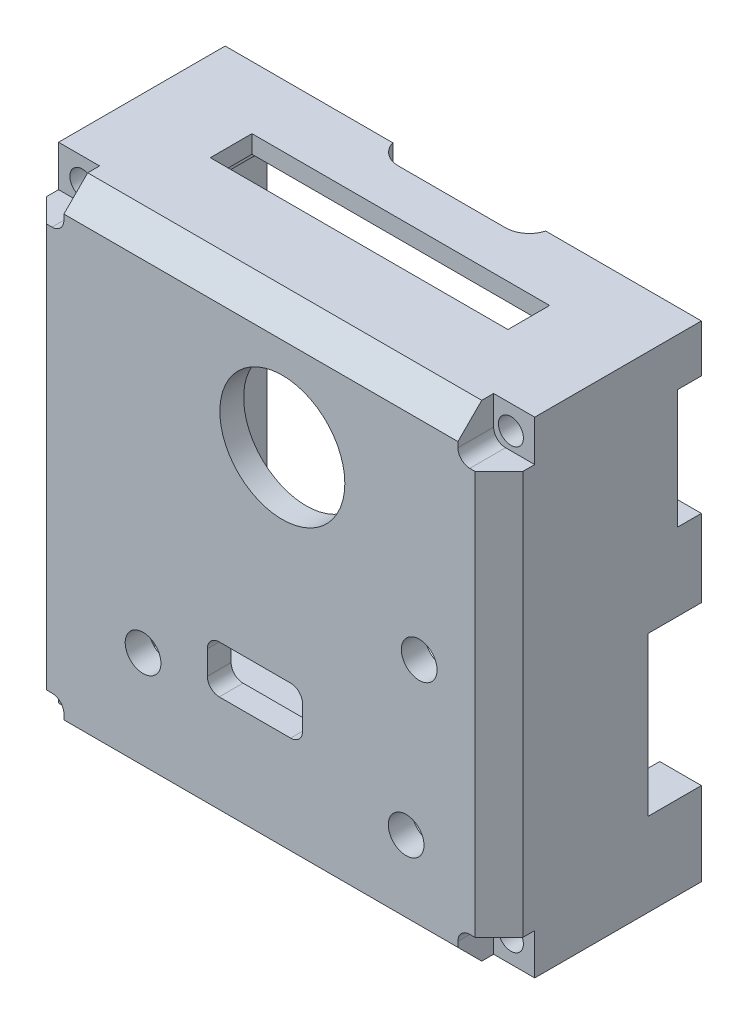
SolidWorks part; units mm, degrees
ref_plane "Alzado" through (0, 0, 0) normal (0, 0, 1) x (1, 0, 0)
ref_plane "Planta" through (0, 0, 0) normal (0, 1, 0) x (1, 0, 0)
ref_plane "Vista lateral" through (0, 0, 0) normal (1, 0, 0) x (0, 0, -1)
sketch "Sketch1" plane through (0, 0, 0) normal (0, 0, 1) x (1, 0, 0)
  line L6 (-20, 20.4) -> (20, 20.4)
  line L11 (-20, 20.4) -> (-20, -20.4)
  line L12 (-20, -20.4) -> (20, -20.4)
  line L18 (20, 20.4) -> (20, -20.4)
  line L19 (-20, 20.4) -> (20, -20.4) construction
  line L20 (-20, -20.4) -> (20, 20.4) construction
  point P0 (0, 0)
extrude "Boss-Extrude1" add sketch "Sketch1" along normal blind 17
sketch "Sketch2" plane through (0, 0, 0) normal (0, 0, -1) x (-1, 0, 0)
  line L1 (-16.5, -16.8) -> (16.5, -16.8)
  line L2 (-16.5, -16.8) -> (-16.5, 16.8)
  line L3 (-16.5, 16.8) -> (16.5, 16.8)
  line L4 (16.5, -16.8) -> (16.5, 16.8)
  line L5 (-16.5, -16.8) -> (16.5, 16.8) construction
  line L6 (-16.5, 16.8) -> (16.5, -16.8) construction
  point P0 (0, 0)
extrude "Cut-Extrude1" cut sketch "Sketch2" against normal blind 15
sketch "Sketch3" plane through (-20, 0, 0) normal (-1, 0, 0) x (0, 0, 1)
  line L0 (0, 20.4) -> (0, -20.4) construction
  line L1 (-2, 16.8) -> (2, 16.8)
  line L2 (-2, 16.8) -> (-2, -8.2)
  line L3 (-2, -8.2) -> (2, -8.2)
  line L4 (2, 16.8) -> (2, -8.2)
  line L5 (-2, 16.8) -> (2, -8.2) construction
  line L6 (-2, -8.2) -> (2, 16.8) construction
  line L7 (17, 20.4) -> (0, 20.4) construction
  point P0 (0, 4.3)
  dimension "D1" = 25
  dimension "D2" = 4
  dimension "D3" = 3.6
sketch "Sketch4" plane through (20, 0, 0) normal (1, 0, 0) x (0, 0, -1)
  line L0 (0, -20.4) -> (0, 20.4) construction
  line L1 (-2, 16.4) -> (2, 16.4)
  line L2 (-2, 16.4) -> (-2, 6.4)
  line L3 (-2, 6.4) -> (2, 6.4)
  line L4 (2, 16.4) -> (2, 6.4)
  line L5 (-2, 16.4) -> (2, 6.4) construction
  line L6 (-2, 6.4) -> (2, 16.4) construction
  line L7 (-17, 20.4) -> (0, 20.4) construction
  line L9 (-4.5, -0.1) -> (4.5, -0.1)
  line L10 (-4.5, -0.1) -> (-4.5, -13.4)
  line L11 (-4.5, -13.4) -> (4.5, -13.4)
  line L12 (4.5, -0.1) -> (4.5, -13.4)
  line L13 (-4.5, -0.1) -> (4.5, -13.4) construction
  line L14 (-4.5, -13.4) -> (4.5, -0.1) construction
  point P0 (0, 11.4)
  point P9 (0, -6.75)
  dimension "D1" = 4
  dimension "D2" = 10
  dimension "D3" = 4
  dimension "D4" = 6.5
  dimension "D5" = 13.3
  dimension "D6" = 9
extrude "Cut-Extrude3" cut sketch "Sketch4" against normal blind 7
sketch "Sketch5" plane through (0, 0, 17) normal (0, 0, 1) x (1, 0, 0)
  line L0 (-20, 20.4) -> (-20, -20.4) construction
  line L1 (20, 20.4) -> (-20, 20.4) construction
  line L2 (20, -20.4) -> (20, 20.4) construction
  line L3 (-9.8701, 0) -> (10.2428, 0) construction
  circle A0 centre (-18, 18.4) radius 1.05
  circle A1 centre (18, 18.4) radius 1.05
  circle A2 centre (18, -18.4) radius 1.05
  circle A3 centre (-18, -18.4) radius 1.05
  dimension "D1" = 2.1
  dimension "D2" = 2
  dimension "D3" = 2
  dimension "D5" = 2
  dimension "D4" = 2
extrude "Cut-Extrude4" cut sketch "Sketch5" against normal blind 20
sketch "Sketch6" plane through (0, 0, 17) normal (0, 0, 1) x (1, 0, 0)
  line L5 (16.55, 20.4) -> (20, 20.4)
  line L6 (-20, 20.4) -> (-16.55, 20.4)
  line L10 (-20, 20.4) -> (-20, 16.95)
  line L11 (-20, 16.95) -> (-16.55, 16.95)
  line L12 (-9.7242, 0) -> (6.6061, 0) construction
  line L13 (16.55, 20.4) -> (16.55, 16.95)
  line L14 (16.55, 16.95) -> (20, 16.95)
  line L15 (20, 20.4) -> (20, 16.95)
  line L16 (-16.55, -20.4) -> (-16.55, -16.95)
  line L25 (-16.55, 20.4) -> (-16.55, 16.95)
  line L26 (20, -20.4) -> (20, 20.4) construction
  line L27 (20, -20.4) -> (20, -16.95)
  line L28 (16.55, -16.95) -> (20, -16.95)
  line L29 (16.55, -20.4) -> (16.55, -16.95)
  line L30 (-20, -16.95) -> (-16.55, -16.95)
  line L31 (-20, -20.4) -> (-20, -16.95)
  line L32 (-20, -20.4) -> (-16.55, -20.4)
  line L33 (16.55, -20.4) -> (20, -20.4)
  dimension "D1" = 3.45
  dimension "D2" = 3.45
  dimension "D3" = 2
extrude "Cut-Extrude6" cut sketch "Sketch6" against normal blind 3
sketch "Sketch7" plane through (0, 0, 17) normal (0, 0, 1) x (1, 0, 0)
  line L0 (-20, 16.95) -> (-20, -16.95) construction
  line L7 (-16.55, -20.4) -> (16.55, -20.4) construction
  line L8 (-4.5, -6.2) -> (3.5, -6.2)
  line L9 (-4.5, -6.2) -> (-4.5, -10.2)
  line L10 (-4.5, -10.2) -> (3.5, -10.2)
  line L11 (3.5, -6.2) -> (3.5, -10.2)
  line L12 (-4.5, -6.2) -> (3.5, -10.2) construction
  line L13 (-4.5, -10.2) -> (3.5, -6.2) construction
  line L14 (20, -16.95) -> (20, 16.95) construction
  circle A0 centre (-9.9, -10.2) radius 1.5
  circle A1 centre (12.2, -12.4) radius 1.5
  circle A2 centre (13.3, 0.9) radius 1.5
  circle A9 centre (1.8, 10.6) radius 5.25
  point P10 (-0.5, -8.2)
  dimension "D9" = 3
  dimension "D11" = 10.2
  dimension "D12" = 3
  dimension "D15" = 3
  dimension "D2" = 10.5
  dimension "D3" = 31
  dimension "D4" = 21.8
  dimension "D5" = 10.2
  dimension "D6" = 4
  dimension "D7" = 8
  dimension "D10" = 9.4
  dimension "D13" = 12.7
  dimension "D14" = 8
  dimension "D16" = 6.7
  dimension "D17" = 13.3
extrude "Cut-Extrude7" cut sketch "Sketch7" against normal blind 3
chamfer "Chamfer1" distance 2 angle 45 4 edges at (0, 20.4, 17) (0, -20.4, 17) (20, 0, 17) (-20, 0, 17)
fillet "Fillet1" radius 1 4 edges at (-4.5, -10.2, 16) (3.5, -10.2, 16) (3.5, -6.2, 16) (-4.5, -6.2, 16)
fillet "Fillet2" radius 1 4 edges at (-16.55, 16.95, 15.5) (16.55, 16.95, 15.5) (16.55, -16.95, 15.5) (-16.55, -16.95, 15.5)
sketch "Sketch8" plane through (0, 20.4, 0) normal (0, 1, 0) x (1, 0, 0)
  line L5 (-4, -1.45) -> (5, -1.45)
  line L6 (-6, 0.55) -> (-6, 1.05)
  line L7 (-4, 3.05) -> (5, 3.05)
  line L8 (7, 0.55) -> (7, 1.05)
  line L9 (-6, -1.45) -> (7, 3.05) construction
  line L10 (-6, 3.05) -> (7, -1.45) construction
  line L12 (-20, -14) -> (-20, 0) construction
  line L13 (20, 0) -> (-20, 0) construction
  arc A2 (-6, 1.05) -> (-4, 3.05) centre (-4, 1.05) cw
  arc A3 (-6, 0.55) -> (-4, -1.45) centre (-4, 0.55) ccw
  arc A4 (7, 1.05) -> (5, 3.05) centre (5, 1.05) ccw
  arc A5 (7, 0.55) -> (5, -1.45) centre (5, 0.55) cw
  point P0 (0.5, 0.8)
  dimension "D1" = 13
  dimension "D2" = 4.5
  dimension "D3" = 14
  dimension "D4" = 2
  dimension "D5" = 2
  dimension "D6" = 0.8
extrude "Cut-Extrude8" cut sketch "Sketch8" against normal blind 10
sketch "Sketch9" plane through (0, 0, 0) normal (0, 0, -1) x (-1, 0, 0)
  line L0 (4, 16.8) -> (-5, 16.8) construction
  line L1 (-15.3782, 14.7) -> (14.3782, 14.7)
  line L2 (-15.3782, 14.7) -> (-15.3782, 18.9)
  line L3 (-15.3782, 18.9) -> (14.3782, 18.9)
  line L4 (14.3782, 14.7) -> (14.3782, 18.9)
  line L5 (-15.3782, 14.7) -> (14.3782, 18.9) construction
  line L6 (-15.3782, 18.9) -> (14.3782, 14.7) construction
  line L7 (5.9229, 20.4) -> (20, 20.4) construction
  point P0 (-0.5, 16.8)
  dimension "D1" = 1.5
extrude "Cut-Extrude9" cut sketch "Sketch9" against normal up to surface (15 mm away)
sketch "Sketch10" plane through (0, 20.4, 0) normal (0, 1, 0) x (1, 0, 0)
  line L0 (20, 0) -> (6.9229, 0) construction
  line L1 (-12.5, -5.25) -> (12.5, -5.25)
  line L2 (-12.5, -5.25) -> (-12.5, -8.75)
  line L3 (-12.5, -8.75) -> (12.5, -8.75)
  line L4 (12.5, -5.25) -> (12.5, -8.75)
  line L5 (-12.5, -5.25) -> (12.5, -8.75) construction
  line L6 (-12.5, -8.75) -> (12.5, -5.25) construction
  point P0 (0, -7)
  dimension "D1" = 3.5
  dimension "D2" = 25
  dimension "D3" = 7
extrude "Cut-Extrude10" cut sketch "Sketch10" against normal blind 10
equation "\"alto\"= 17"
equation "\"ancho\"= 40"
equation "\"placa_ancho\"= 33"
equation "\"placa_largo\"= 33.6"
equation "\"largo\"= 40.8"
equation "\"D1@Sketch2\"=\"placa_largo\""
equation "\"D2@Sketch2\"=\"placa_ancho\""
equation "\"D1@Cut-Extrude1\"=\"alto\"-2"
equation "\"D2@Sketch1\"=\"ancho\""
equation "\"D1@Sketch1\"=\"largo\""
equation "\"D1@Boss-Extrude1\"=\"alto\""
